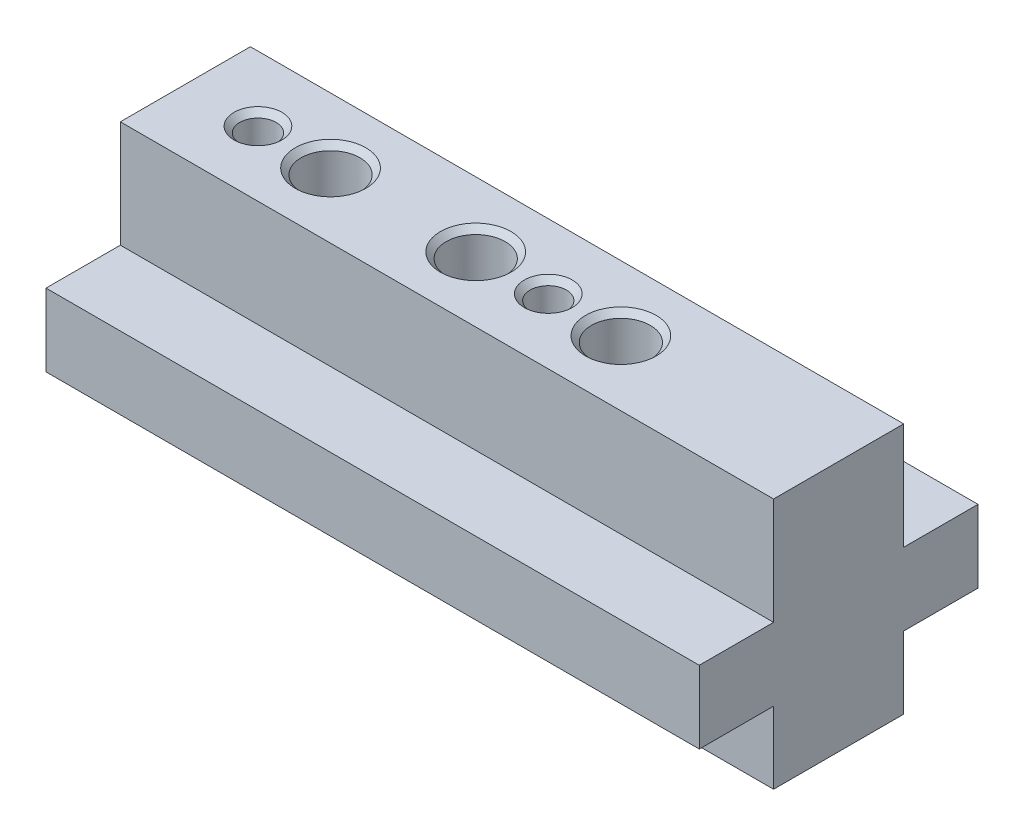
SolidWorks part; units mm, degrees
ref_plane "Front Plane" through (0, 0, 0) normal (0, 0, 1) x (1, 0, 0)
ref_plane "Top Plane" through (0, 0, 0) normal (0, 1, 0) x (1, 0, 0)
ref_plane "Right Plane" through (0, 0, 0) normal (1, 0, 0) x (0, 0, -1)
sketch "Sketch1" plane through (0, 0, 0) normal (1, 0, 0) x (0, 0, -1)
  line L0 (-6.096, 1.5875) -> (-6.096, -1.5875)
  line L1 (-6.096, -1.5875) -> (-2.8448, -1.5875)
  line L2 (-2.8448, -1.5875) -> (-2.8448, -4.7371)
  line L3 (-2.8448, -4.7371) -> (2.8448, -4.7371)
  line L4 (2.8448, -4.7371) -> (2.8448, -1.5875)
  line L5 (2.8448, -1.5875) -> (6.096, -1.5875)
  line L6 (6.096, -1.5875) -> (6.096, 1.5875)
  line L7 (6.096, 1.5875) -> (2.8448, 1.5875)
  line L8 (2.8448, 1.5875) -> (2.8448, 6.2611)
  line L9 (2.8448, 6.2611) -> (-2.8448, 6.2611)
  line L10 (-2.8448, 6.2611) -> (-2.8448, 1.5875)
  line L11 (-2.8448, 1.5875) -> (-6.096, 1.5875)
  line L12 (-6.096, 0) -> (6.096, 0) construction
  point P12 (-6.096, 0)
  dimension "D1" = 10.9982
  dimension "D2" = 5.6896
  dimension "D3" = 12.192
  dimension "D4" = 3.175
  dimension "D5" = 6.2611
extrude "Extrude1" add sketch "Sketch1" along normal blind 28.575
hole_wizard "#5-40 Tapped Hole1" positions "Sketch3" profile "Sketch2" tap size "#5-40" standard "ANSI Inch"
sketch "Sketch3" plane through (0, 6.2611, 0) normal (0, 1, 0) x (-1, 0, 0)
  line L0 (0, -2.8448) -> (0, 2.8448) construction
  point P0 (-6.35, 0)
  point P2 (-12.7, 0)
  point P8 (-19.05, 0)
  dimension "D1" = 6.35
  dimension "D2" = 6.35
  dimension "D3" = 12.7
sketch "Sketch2" plane through (6.35, 6.2611, 0) normal (1, 0, 0) x (0, 0, 1)
  line L0 (0, 0) -> (0, 7.4547)
  line L1 (0, 7.4547) -> (1.289, 6.6802)
  line L2 (1.289, 6.6802) -> (1.289, 0)
  line L5 (1.289, 0) -> (0, 0)
  line L10 (0, 7.4547) -> (-1.2891, 6.6802) construction
  line L11 (0, -6.35) -> (0, 107.95) construction
  dimension "Tap Drill Dia." = 2.5781
  dimension "Tap Drill Depth" = 6.6802
  dimension "Drill Angle" = 118
hole_wizard "Hole1" positions "Sketch5" profile "Sketch4" legacy
sketch "Sketch5" plane through (0, 6.2611, 0) normal (0, 1, 0) x (-1, 0, 0)
  line L0 (0, -2.8448) -> (0, 2.8448) construction
  point P0 (-3.175, 0)
  point P6 (-15.875, 0)
  dimension "D1" = 3.175
  dimension "D2" = 12.7
sketch "Sketch4" plane through (3.175, 6.2611, 0) normal (1, 0, 0) x (0, 0, 1)
  line L0 (0, 0) -> (0, 3.6519)
  line L1 (0, 3.6519) -> (0.7937, 3.175)
  line L2 (0.7937, 3.175) -> (0.7937, 0)
  line L4 (0.7937, 0) -> (0, 0)
  line L6 (0, 3.6519) -> (-0.7937, 3.175) construction
  line L7 (0, -4.2442) -> (0, 117.3081) construction
  dimension "Diameter" = 1.5875
  dimension "Depth" = 3.175
  dimension "Drill Angle" = 118
chamfer "Chamfer1" distance 0.254 angle 45 5 edges at (3.175, 6.2611, 0.7938) (12.7, 6.2611, 1.289) (6.35, 6.2611, 1.2891) (19.05, 6.2611, 1.2891) (15.875, 6.2611, 0.7938)
